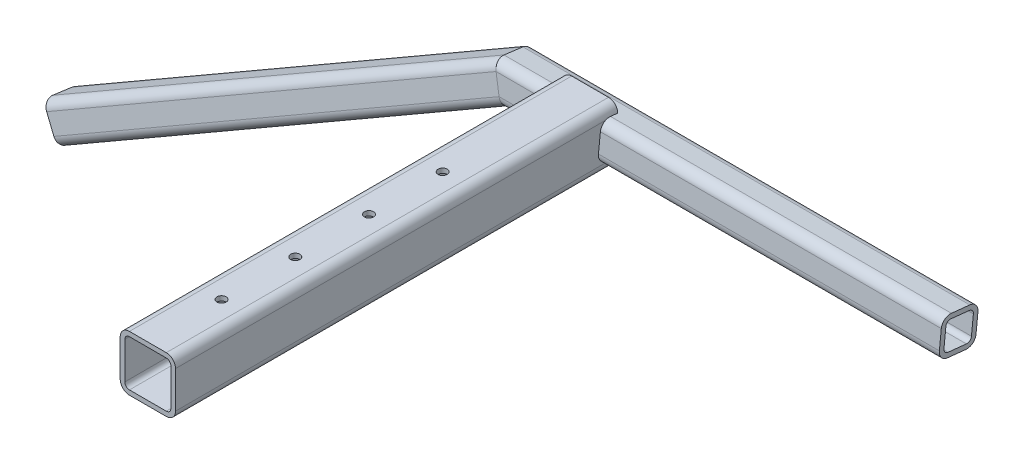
SolidWorks part; units mm, degrees
ref_plane "Front Plane" through (0, 0, 0) normal (0, 0, 1) x (1, 0, 0)
ref_plane "Top Plane" through (0, 0, 0) normal (0, 1, 0) x (1, 0, 0)
ref_plane "Right Plane" through (0, 0, 0) normal (1, 0, 0) x (0, 0, -1)
sketch3d "3DSketch1"
  line L0 (0, 0, 0) -> (-609.6, 0, 0)
  line L1 (-609.6, 0, 0) -> (-1225.5173, -355.6, 0)
  line L2 (-508, 0, 0) -> (-508, 0, 609.6)
  dimension "D1" = 609.6
  dimension "D2" = 711.2
  dimension "D3" = 30
  dimension "D4" = 609.6
  dimension "D5" = 101.6
other "Square tube 2 X 2 X 0.25(1)"
ref_plane "Plane1" through (-609.6, 0, 0) normal (-0.866, -0.5, 0) x (-0.0523, 0.0905, 0.9945)
sketch "Sketch1" plane through (-609.6, 0, 0) normal (-0.866, -0.5, 0) x (-0.0523, 0.0905, 0.9945)
  line L0 (-12.7, -19.05) -> (12.7, -19.05)
  line L1 (-19.05, -12.7) -> (-19.05, 12.7)
  line L2 (12.7, 19.05) -> (-12.7, 19.05)
  line L3 (19.05, 12.7) -> (19.05, -12.7)
  line L4 (-12.7, -25.4) -> (12.7, -25.4)
  line L5 (-25.4, -12.7) -> (-25.4, 12.7)
  line L6 (12.7, 25.4) -> (-12.7, 25.4)
  line L7 (25.4, 12.7) -> (25.4, -12.7)
  line L8 (0, 0) -> (19.05, 0) construction
  line L9 (0, 0) -> (0, 19.05) construction
  arc A0 (25.4, 12.7) -> (12.7, 25.4) centre (12.7, 12.7) ccw
  arc A1 (12.7, -25.4) -> (25.4, -12.7) centre (12.7, -12.7) ccw
  arc A2 (-25.4, -12.7) -> (-12.7, -25.4) centre (-12.7, -12.7) ccw
  arc A3 (-12.7, 25.4) -> (-25.4, 12.7) centre (-12.7, 12.7) ccw
  arc A4 (-12.7, 19.05) -> (-19.05, 12.7) centre (-12.7, 12.7) ccw
  arc A5 (19.05, 12.7) -> (12.7, 19.05) centre (12.7, 12.7) ccw
  arc A6 (12.7, -19.05) -> (19.05, -12.7) centre (12.7, -12.7) ccw
  arc A7 (-19.05, -12.7) -> (-12.7, -19.05) centre (-12.7, -12.7) ccw
  point P3 (0, 25.4)
  point P4 (25.4, 0)
  point P5 (0, -25.4)
  point P6 (-25.4, 0)
  point P7 (-25.4, 25.4)
  point P8 (-25.4, -25.4)
  point P33 (0, 0)
  point P35 (25.4, -25.4)
  point P36 (25.4, 25.4)
  point P37 (0, 0)
  dimension "D1" = 12.7
  dimension "Thickness" = 6.35
  dimension "V_leg" = 50.8
other "Square tube 3 X 3 X 0.25(1)"
ref_plane "Plane2" through (-508, 0, 0) normal (0, 0, 1) x (1, 0, 0)
sketch "Sketch13" plane through (-508, 0, 0) normal (0, 0, 1) x (1, 0, 0)
  line L0 (-25.4, -31.75) -> (25.4, -31.75)
  line L1 (-31.75, -25.4) -> (-31.75, 25.4)
  line L2 (25.4, 31.75) -> (-25.4, 31.75)
  line L3 (31.75, 25.4) -> (31.75, -25.4)
  line L4 (-25.4, -38.1) -> (25.4, -38.1)
  line L5 (-38.1, -25.4) -> (-38.1, 25.4)
  line L6 (25.4, 38.1) -> (-25.4, 38.1)
  line L7 (38.1, 25.4) -> (38.1, -25.4)
  line L8 (0, 0) -> (31.75, 0) construction
  line L9 (0, 0) -> (0, 31.75) construction
  arc A0 (38.1, 25.4) -> (25.4, 38.1) centre (25.4, 25.4) ccw
  arc A1 (25.4, -38.1) -> (38.1, -25.4) centre (25.4, -25.4) ccw
  arc A2 (-38.1, -25.4) -> (-25.4, -38.1) centre (-25.4, -25.4) ccw
  arc A3 (-25.4, 38.1) -> (-38.1, 25.4) centre (-25.4, 25.4) ccw
  arc A4 (-25.4, 31.75) -> (-31.75, 25.4) centre (-25.4, 25.4) ccw
  arc A5 (31.75, 25.4) -> (25.4, 31.75) centre (25.4, 25.4) ccw
  arc A6 (25.4, -31.75) -> (31.75, -25.4) centre (25.4, -25.4) ccw
  arc A7 (-31.75, -25.4) -> (-25.4, -31.75) centre (-25.4, -25.4) ccw
  point P3 (0, 38.1)
  point P4 (38.1, 0)
  point P5 (0, -38.1)
  point P6 (-38.1, 0)
  point P7 (-38.1, 38.1)
  point P8 (-38.1, -38.1)
  point P33 (0, 0)
  point P35 (38.1, -38.1)
  point P36 (38.1, 38.1)
  point P37 (0, 0)
  dimension "D1" = 12.7
  dimension "Thickness" = 6.35
  dimension "V_leg" = 76.2
sketch "Sketch14" plane through (0, 38.1, 0) normal (0, 1, 0) x (1, 0, 0)
  line L0 (-508, 0) -> (-508, -609.6) construction
  line L1 (-482.6, -609.6) -> (-533.4, -609.6) construction
  circle A0 centre (-508, -508) radius 6.35
  circle A1 centre (-508, -406.4) radius 6.35
  circle A2 centre (-508, -304.8) radius 6.35
  circle A3 centre (-508, -203.2) radius 6.35
  dimension "D1" = 12.7
  dimension "D4" = 101.6
  dimension "D5" = 101.6
  dimension "D2" = 101.6
  dimension "D3" = 101.6
extrude "Cut-Extrude1" cut sketch "Sketch14" against normal through all
